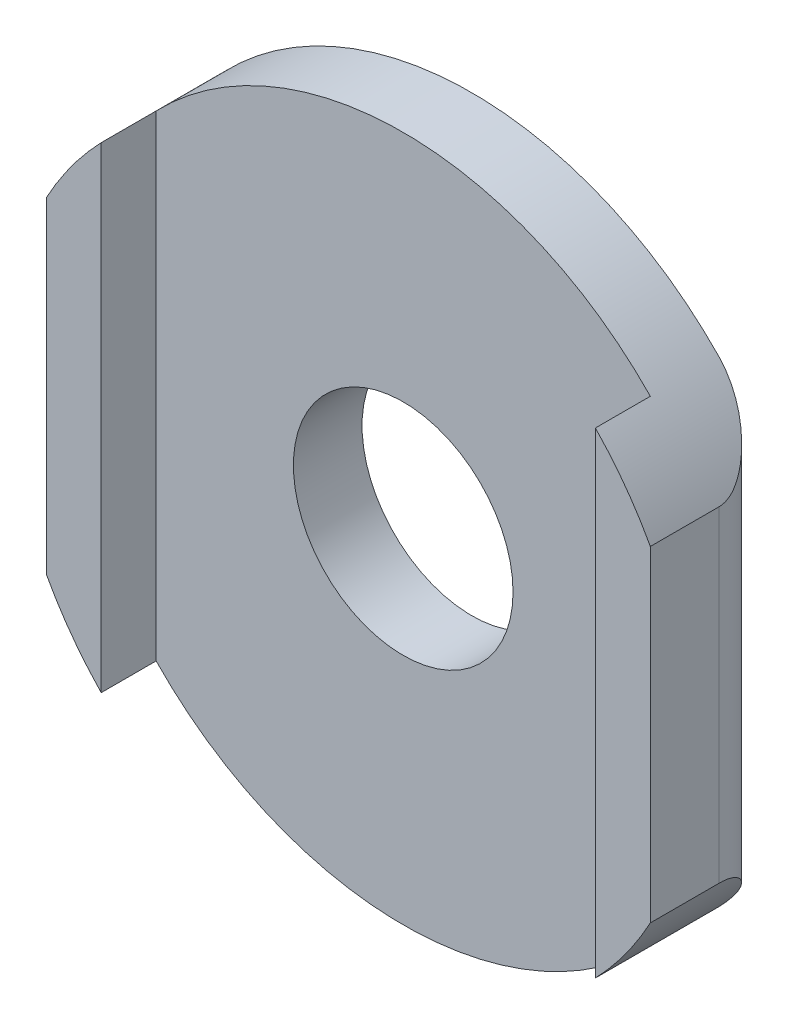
SolidWorks part; units mm, degrees
ref_plane "Front Plane" through (0, 0, 0) normal (0, 0, 1) x (1, 0, 0)
ref_plane "Top Plane" through (0, 0, 0) normal (0, 1, 0) x (1, 0, 0)
ref_plane "Right Plane" through (0, 0, 0) normal (1, 0, 0) x (0, 0, -1)
sketch "Sketch1" plane through (0, 0, 0) normal (0, 0, 1) x (1, 0, 0)
  circle A0 centre (0, 0) radius 12.5
  dimension "D1" = 25
extrude "Extrude1" add sketch "Sketch1" along normal blind 2.5
sketch "Sketch2" plane through (0, 0, 2.5) normal (0, 0, 1) x (1, 0, 0)
  line L0 (-11, 5.9372) -> (-11, -5.9372)
  line L1 (-9, 8.6747) -> (-9, -8.6747)
  arc A0 (-9, 8.6747) -> (-11, 5.9372) centre (0, 0) ccw
  circle A1 centre (0, 0) radius 12.5
  arc A2 (-11, -5.9372) -> (-9, -8.6747) centre (0, 0) ccw
  dimension "D2" = 11
  dimension "D3" = 2
  dimension "D1" = 0
extrude "Extrude2" add sketch "Sketch2" along normal blind 2
mirror "Mirror1" about plane through (0, 0, 0) normal (1, 0, 0) of "Extrude2"
sketch "Sketch3" plane through (0, 0, 2.5) normal (0, 0, 1) x (1, 0, 0)
  line L1 (11, 5.9372) -> (11, -5.9372)
  line L2 (11, 5.9372) -> (11, -5.9372)
  line L3 (-11, -5.9372) -> (-11, 5.9372)
  line L4 (-11, -5.9372) -> (-11, 5.9372)
  arc A1 (11, -5.9372) -> (11, 5.9372) centre (0, 0) ccw
  arc A2 (11, -5.9372) -> (11, 5.9372) centre (0, 0) ccw
  arc A3 (-11, 5.9372) -> (-11, -5.9372) centre (0, 0) ccw
  arc A4 (-11, 5.9372) -> (-11, -5.9372) centre (0, 0) ccw
  dimension "D1" = 0
  dimension "D2" = 0
extrude "Extrude3" cut sketch "Sketch3" against normal through all
sketch "Sketch4" plane through (0, 0, 2.5) normal (0, 0, 1) x (1, 0, 0)
  circle A0 centre (0, 0) radius 4
  dimension "D1" = 8
extrude "Extrude4" cut sketch "Sketch4" against normal through all
fillet "Fillet1" radius 2 2 edges at (-11, 0, 0) (11, 0, 0)
